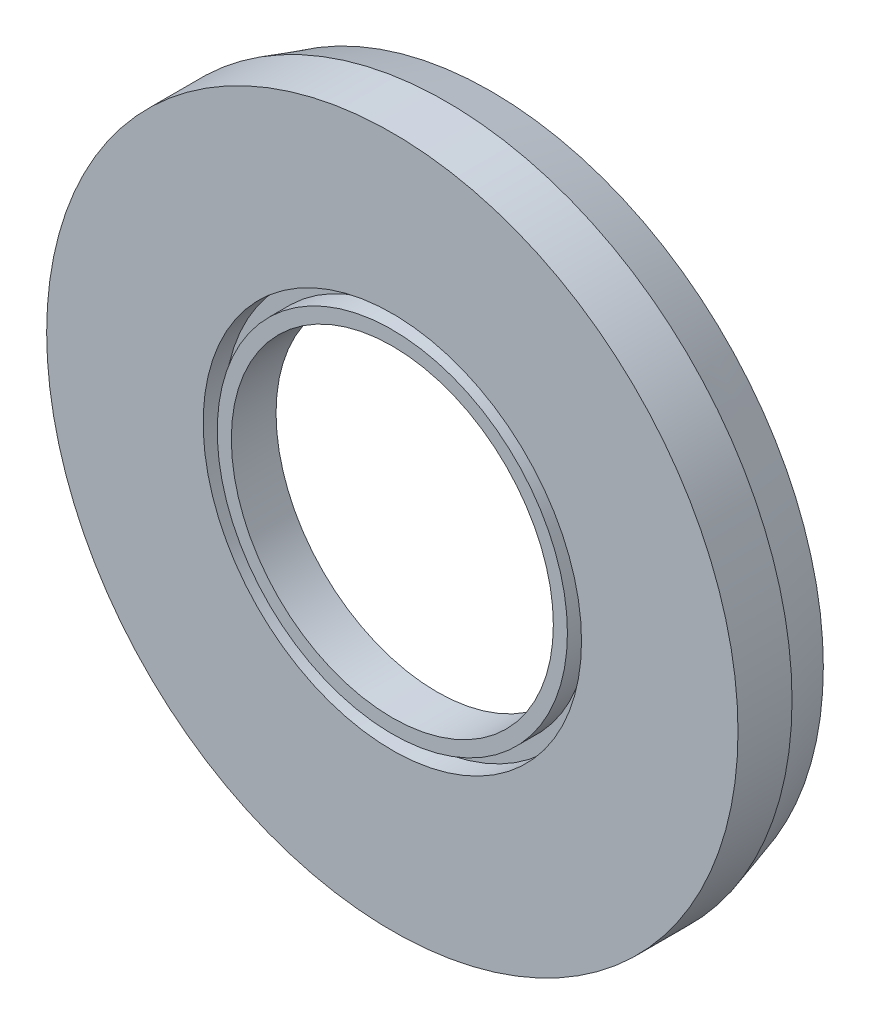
SolidWorks part; units mm, degrees
ref_plane "Front Plane" through (0, 0, 0) normal (0, 0, 1) x (1, 0, 0)
ref_plane "Top Plane" through (0, 0, 0) normal (0, 1, 0) x (1, 0, 0)
ref_plane "Right Plane" through (0, 0, 0) normal (1, 0, 0) x (0, 0, -1)
sketch "Sketch1" plane through (0, 0, 0) normal (0, 0, 1) x (1, 0, 0)
  circle A0 centre (0, 0) radius 24.5389
  circle A1 centre (0, 0) radius 11.43
  dimension "D1" = 49.0779
  dimension "D2" = 22.86
extrude "Boss-Extrude1" add sketch "Sketch1" along normal blind 3.175
sketch "Sketch2" plane through (0, 0, 0) normal (0, 1, 0) x (1, 0, 0)
  line L0 (-23.5864, 3.8354) -> (-24.5389, 0.6604)
  line L1 (-24.5389, 0.6604) -> (-24.5389, 0)
  line L2 (-23.5864, 3.8354) -> (-23.5864, 0.0254)
  line L3 (-23.5864, 0.0254) -> (-22.3164, 0.0254)
  line L4 (-22.3164, 0.0254) -> (-22.3164, 3.8354)
  line L5 (-22.3164, 3.8354) -> (-21.3639, 0.6604)
  line L6 (-21.3639, 0.6604) -> (-21.3639, 0)
  line L7 (24.5389, 0) -> (-24.5389, 0) construction
  line L8 (-22.9514, 5.059) -> (-22.9514, -7.1352) construction
  line L9 (-21.3639, 0) -> (-24.5389, 0)
  dimension "D1" = 1.27
  dimension "D2" = 3.8354
  dimension "D3" = 3.175
  dimension "D4" = 3.81
  dimension "D5" = 3.175
ref_axis "Axis1" through (0, 0, 3.175) along (0, 0, -1)
revolve "Revolve1" add sketch "Sketch2" angle 360 about axis through (0, 0, 3.175) along (0, 0, -1)
sketch "Sketch3" plane through (0, 0, 3.175) normal (0, 0, 1) x (1, 0, 0)
  line L0 (0, 26.5008) -> (0, -26.9379) construction
  line L1 (-27.5663, 0) -> (27.457, 0) construction
  circle A0 centre (0, 0) radius 13.43
  circle A1 centre (0, 0) radius 12.43
  circle A2 centre (0, 0) radius 11.43 construction
  dimension "D1" = 1
  dimension "D2" = 1
extrude "Cut-Extrude1" cut sketch "Sketch3" against normal blind 1.5
